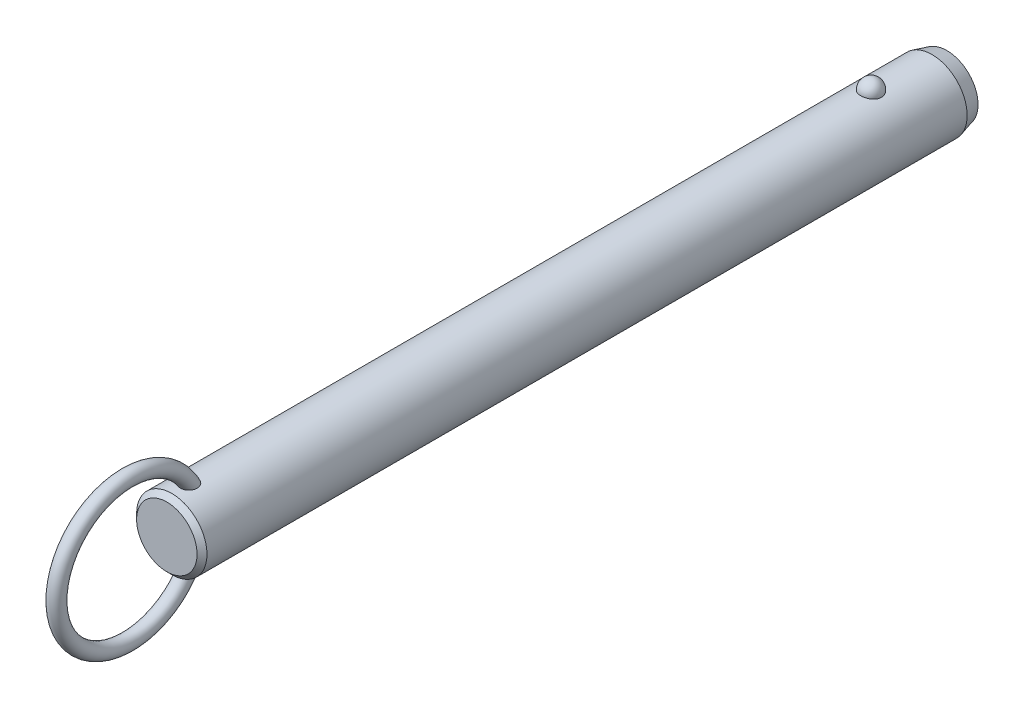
SolidWorks part; units mm, degrees
ref_plane "Front Plane" through (0, 0, 0) normal (0, 0, 1) x (1, 0, 0)
ref_plane "Top Plane" through (0, 0, 0) normal (0, 1, 0) x (1, 0, 0)
ref_plane "Right Plane" through (0, 0, 0) normal (1, 0, 0) x (0, 0, -1)
sketch "Sketch2" plane through (0, 0, 0) normal (0, 0, 1) x (1, 0, 0)
  circle A0 centre (0, 0) radius 7.1
  point P3 (0, 7.1)
  dimension "D1" = 14.2
extrude "Boss-Extrude1" add sketch "Sketch2" along normal blind 132.1
sketch "Sketch3" plane through (0, 0, 0) normal (0, 0, -1) x (-1, 0, 0)
  circle A0 centre (0, 0) radius 7.1
  dimension "D1" = 14.2
extrude "Boss-Extrude2" add sketch "Sketch3" along normal blind 17.4
chamfer "Chamfer1" distance 3 angle 15 1 edges at (-7.1, 0, -17.4)
sketch "Sketch12" plane through (0, 0, 0) normal (1, 0, 0) x (0, 0, -1)
  line L0 (-132.1, 7.1) -> (-132.1, -7.1) construction
  point P0 (-132.1, 0)
sketch "Sketch13" plane through (0, 0, 0) normal (1, 0, 0) x (0, 0, -1)
  circle A0 centre (-147.95, 0) radius 15.85
  point P2 (-132.1, 0)
  dimension "D1" = 31.7
sketch "Sketch14" plane through (0, 0, 0) normal (0, 1, 0) x (1, 0, 0)
  circle A0 centre (0, -133.6) radius 1.5
  point P2 (0, -132.1)
  dimension "D1" = 3
sweep "Sweep1" add profiles "Sketch14" path "Sketch13"
sketch "Sketch15" plane through (0, 0, 132.1) normal (0, 0, 1) x (1, 0, 0)
  circle A0 centre (0, 0) radius 7.1
  dimension "D1" = 14.2
extrude "Boss-Extrude3" add sketch "Sketch15" along normal blind 7.92
chamfer "Chamfer2" distance 1 angle 45 1 edges at (7.1, 0, 140.02)
sketch "Sketch18" plane through (0, 0, 0) normal (1, 0, 0) x (0, 0, -1)
  line L0 (14.4, 7.1) -> (-133.7792, 7.1) construction
  line L1 (2.1, 9.2) -> (2.1, 5)
  line L2 (-133.7792, -7.1) -> (14.4, -7.1) construction
  arc A0 (2.1, 9.2) -> (2.1, 5) centre (2.1, 7.1) ccw
  point P4 (0, 7.1)
  dimension "D1" = 16.3
revolve "Revolve1" add sketch "Sketch18" angle 360 about L1
